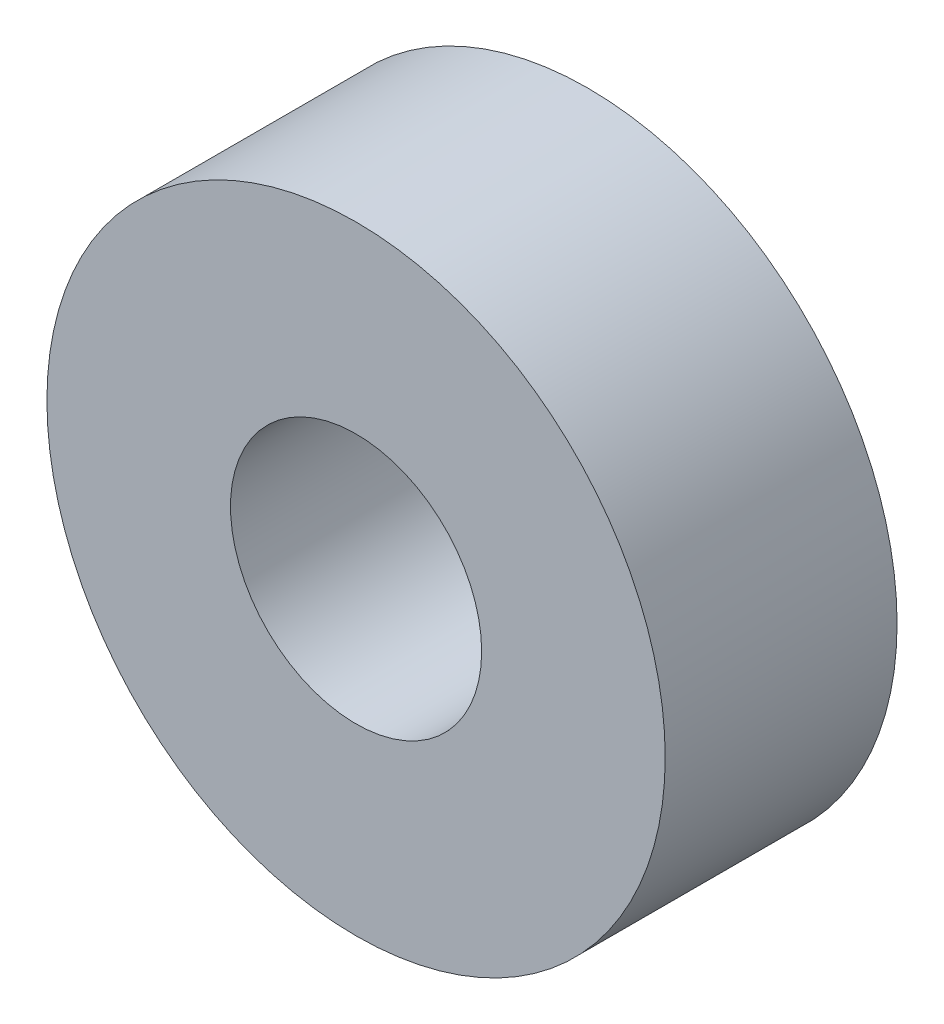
SolidWorks part; units mm, degrees
ref_plane "Plan1" through (0, 0, 0) normal (0, 0, 1) x (1, 0, 0)
ref_plane "Plan2" through (0, 0, 0) normal (0, 1, 0) x (1, 0, 0)
ref_plane "Plan3" through (0, 0, 0) normal (1, 0, 0) x (0, 0, -1)
sketch "Esquisse1" plane through (0, 0, 0) normal (0, 0, 1) x (1, 0, 0)
  circle A0 centre (0, 0) radius 4
  circle A1 centre (0, 0) radius 1.625
  dimension "D1" = 3.25
  dimension "D2" = 8
extrude "Extrusion1" add sketch "Esquisse1" along normal blind 3
